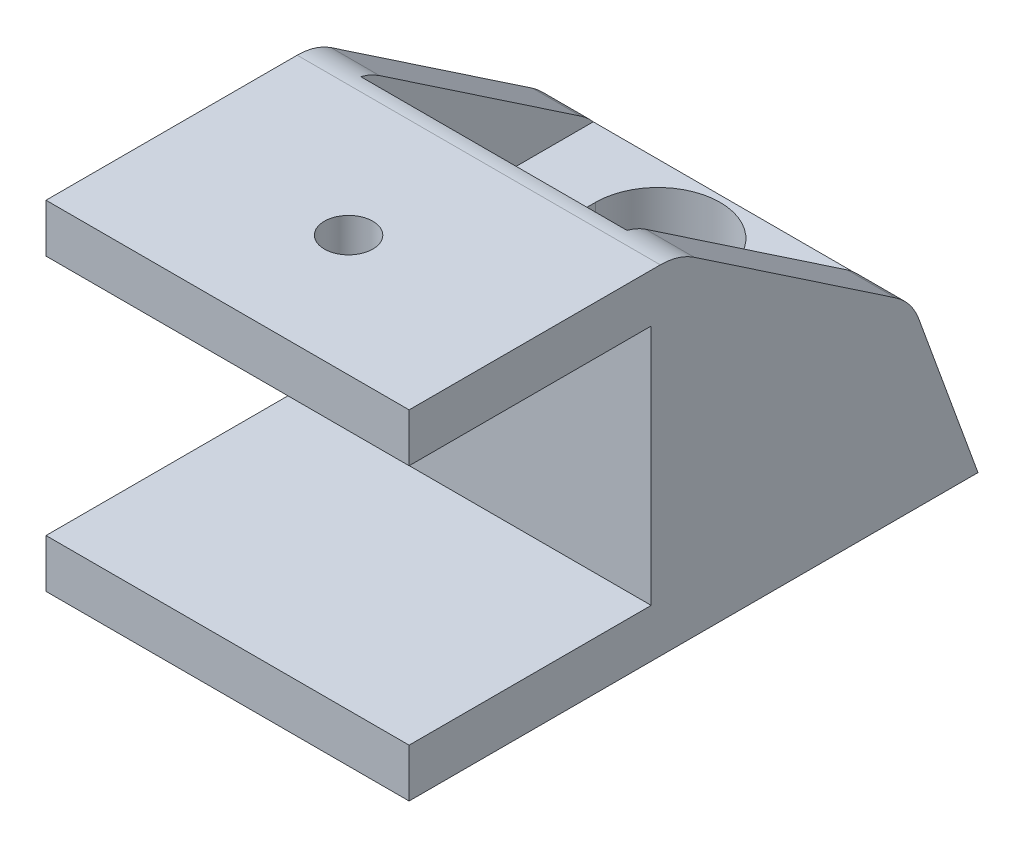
SolidWorks part; units mm, degrees
ref_plane "Alzado" through (0, 0, 0) normal (0, 0, 1) x (1, 0, 0)
ref_plane "Planta" through (0, 0, 0) normal (0, 1, 0) x (1, 0, 0)
ref_plane "Vista lateral" through (0, 0, 0) normal (1, 0, 0) x (0, 0, -1)
sketch "Sketch7" plane through (0, 0, 0) normal (1, 0, 0) x (0, 0, -1)
  line L0 (-36.8125, 23.99) -> (-36.8125, 19.99)
  line L1 (-36.8125, 19.99) -> (-16.8125, 19.99)
  line L2 (-16.8125, 19.99) -> (-16.8125, 0)
  line L3 (-16.8125, 0) -> (-36.8125, 0)
  line L4 (-36.8125, 0) -> (-36.8125, -4)
  line L5 (-36.8125, -4) -> (10.1875, -4)
  line L6 (10.1875, -4) -> (0, 23.99)
  line L7 (0, 23.99) -> (-36.8125, 23.99)
  line L8 (0, 0) -> (87.8092, 0) construction
  line L10 (0, -46.3065) -> (0, 45.8278) construction
  line L11 (-46.8125, -4) -> (-46.8125, 23.99) construction
  line L12 (-46.8125, 23.99) -> (-36.8125, 23.99) construction
  line L13 (-36.8125, -4) -> (-46.8125, -4) construction
  line L14 (-36.8125, 0) -> (-36.8125, 19.99) construction
  dimension "D1" = 4
  dimension "D2" = 19.99
  dimension "D3" = 4
  dimension "D4" = 20
  dimension "D5" = 70
  dimension "D6" = 27
  dimension "D7" = 10
extrude "Boss-Extrude3" add sketch "Sketch7" along normal mid plane 30
sketch "Sketch13" plane through (0, 23.99, 0) normal (0, 1, 0) x (1, 0, 0)
  line L0 (0, 0) -> (0, -36.8125) construction
  line L1 (-10, 0) -> (-10, -36.8125) construction
  line L2 (15, -36.8125) -> (-15, -36.8125) construction
  line L3 (15, 0) -> (-15, 0) construction
  line L4 (15, 0) -> (15, -36.8125) construction
  line L5 (-10, -36.8125) -> (10, -36.8125) construction
  line L6 (-15, 0) -> (-15, -36.8125) construction
  line L7 (-15, -16.8125) -> (15, -16.8125) construction
  line L8 (-15, -26.8125) -> (15, -26.8125) construction
  line L9 (10, -36.8125) -> (10, 0) construction
  circle A0 centre (0, -26.8125) radius 2
  dimension "D3" = 4
  dimension "D1" = 20
  dimension "D2" = 10
  dimension "D4" = 5
  dimension "D5" = 5
extrude "Cut-Extrude4" cut sketch "Sketch13" against normal blind 5
sketch "Sketch15" plane through (0, 23.99, 0) normal (0, 1, 0) x (1, 0, 0)
  line L0 (-11, 10.1875) -> (-11, -14.8125)
  line L1 (15, 10.1875) -> (-15, 10.1875) construction
  line L2 (-11, -14.8125) -> (11, -14.8125)
  line L3 (11, -14.8125) -> (11, 10.1875)
  line L5 (-15, -16.8125) -> (15, -16.8125) construction
  line L6 (-15, 0) -> (-15, -36.8125) construction
  line L7 (15, 0) -> (15, -36.8125) construction
  line L8 (15, -36.8125) -> (-15, -36.8125) construction
  line L9 (-15, 10.1875) -> (-15, 0) construction
  line L10 (-11, 10.1875) -> (-11, 15.1875)
  line L11 (-11, 15.1875) -> (11, 15.1875)
  line L12 (11, 15.1875) -> (11, 10.1875)
  dimension "D1" = 20
  dimension "D2" = 4
  dimension "D3" = 4
  dimension "D4" = 2
  dimension "D5" = 5
extrude "Cut-Extrude6" cut sketch "Sketch15" against normal blind 13
sketch "Sketch16" plane through (0, 10.99, 0) normal (0, 1, 0) x (1, 0, 0)
  line L0 (0, 4.7316) -> (0, -14.8125) construction
  line L1 (-11, 4.7316) -> (11, 4.7316) construction
  line L2 (-11, -14.8125) -> (11, -14.8125) construction
  line L3 (0, -14.8125) -> (11, -5.0404) construction
  line L4 (11, -14.8125) -> (11, 4.7316) construction
  line L5 (11, -5.0404) -> (-11, -5.0404) construction
  line L6 (-11, 0) -> (-11, -14.8125) construction
  line L7 (0, -8.8125) -> (0, -1.2684) construction
  line L8 (-5.15, -8.8125) -> (-5.15, -1.2684)
  line L9 (5.15, -8.8125) -> (5.15, -1.2684)
  arc A0 (-5.15, -8.8125) -> (5.15, -8.8125) centre (0, -8.8125) ccw
  arc A1 (5.15, -1.2684) -> (-5.15, -1.2684) centre (0, -1.2684) ccw
  point P8 (0, -5.0404)
  point P19 (0, 0)
  point P20 (0, -9.2564)
  dimension "D1" = 10.3
  dimension "D2" = 6
sketch "Sketch17" plane through (-15, 0, 0) normal (-1, 0, 0) x (0, 0, 1)
  line L1 (0, 23.99) -> (36.8125, 23.99) construction
  line L2 (-10.1875, -4) -> (0, 23.99) construction
  line L3 (36.8125, -4) -> (-10.1875, -4) construction
  line L4 (36.8125, 23.99) -> (36.8125, 19.99) construction
  line L5 (-4.728, 11) -> (0, 23.99)
  line L6 (0, 23.99) -> (11.8125, 23.99)
  line L7 (-4.728, 11) -> (14.5305, 23.99)
  line L8 (14.5305, 23.99) -> (11.8125, 23.99)
  dimension "D1" = 15
  dimension "D2" = 25
  dimension "D3" = 36
extrude "Cut-Extrude7" cut sketch "Sketch17" against normal blind 45
fillet "Fillet1" radius 5 2 edges at (13, 11, -4.728) (13, 23.99, 14.5305)
extrude "Cut-Extrude8" cut sketch "Sketch16" against normal blind 20
